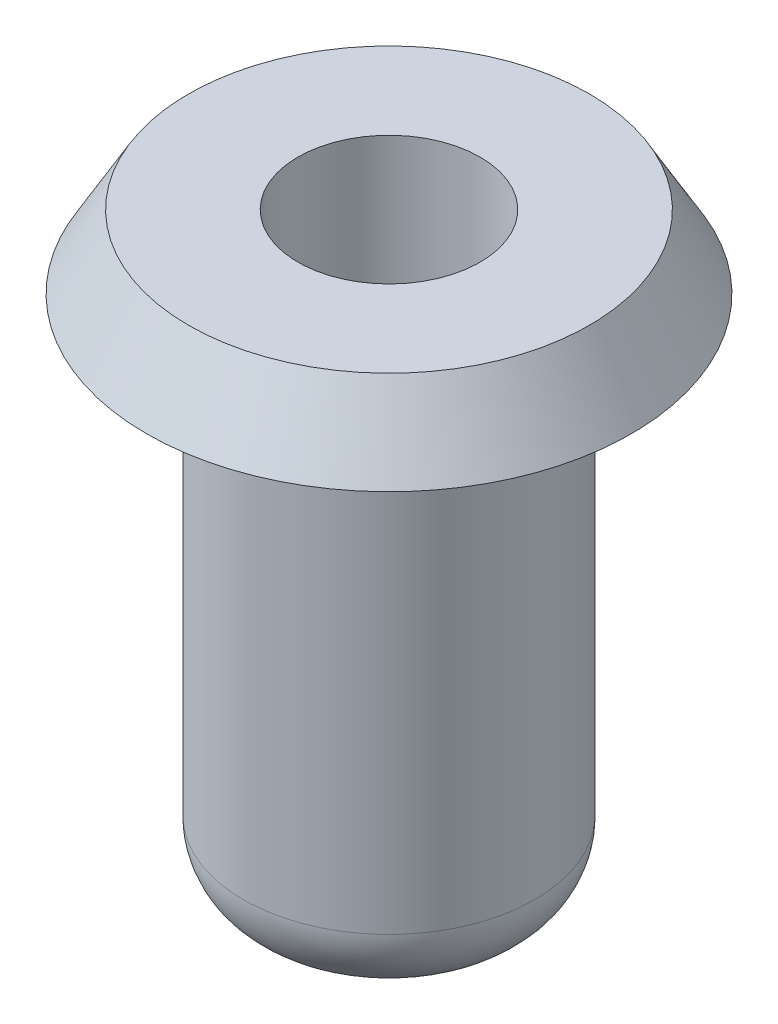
SolidWorks part; units mm, degrees
ref_plane "Plan de face" through (0, 0, 0) normal (0, 0, 1) x (1, 0, 0)
ref_plane "Plan de dessus" through (0, 0, 0) normal (0, 1, 0) x (1, 0, 0)
ref_plane "Plan de droite" through (0, 0, 0) normal (1, 0, 0) x (0, 0, -1)
sketch "Esquisse1" plane through (0, 0, 0) normal (0, 0, 1) x (1, 0, 0)
  line L0 (0, 0) -> (0, 11.6786) construction
  line L1 (-2.75, 8.2) -> (-1.25, 8.2)
  line L2 (-2.75, 8.2) -> (-3.3274, 7.2)
  line L3 (-1.25, 8.2) -> (-1.25, 2)
  line L4 (-1.25, 2) -> (0, 2)
  line L5 (0, 2) -> (0, 0)
  line L6 (0, 0) -> (-1, 0)
  line L7 (-2, 1) -> (-2, 7.2)
  line L8 (-2, 7.2) -> (-3.3274, 7.2)
  arc A0 (-1, 0) -> (-2, 1) centre (-1, 1) cw
  dimension "D8" = 1
  dimension "D1" = 1
  dimension "D2" = 1.5
  dimension "D3" = 120
  dimension "D4" = 2
  dimension "D5" = 1.25
  dimension "D6" = 7.2
  dimension "D7" = 2
revolve "Révolution1" add sketch "Esquisse1" angle 360 about L0
